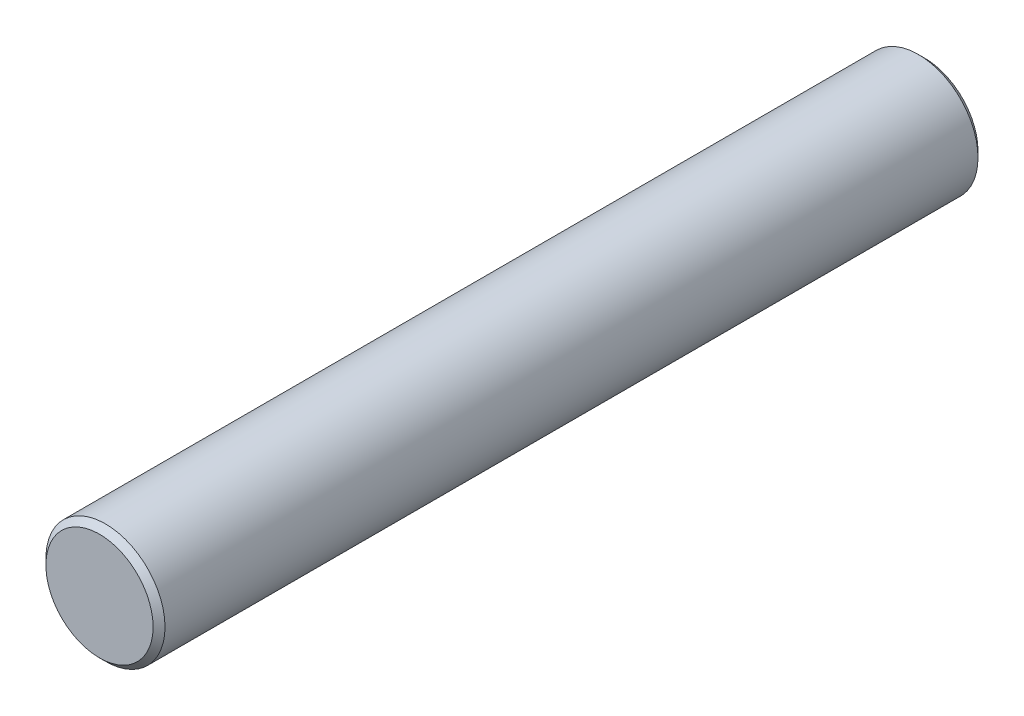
SolidWorks part; units mm, degrees
ref_plane "Plan de face" through (0, 0, 0) normal (0, 0, 1) x (1, 0, 0)
ref_plane "Plan de dessus" through (0, 0, 0) normal (0, 1, 0) x (1, 0, 0)
ref_plane "Plan de droite" through (0, 0, 0) normal (1, 0, 0) x (0, 0, -1)
sketch "Esquisse1" plane through (0, 0, 0) normal (0, 1, 0) x (1, 0, 0)
  line L0 (7, 88.5) -> (0, 84.294)
  line L1 (0, 84.294) -> (0, -138.5)
  line L2 (0, -138.5) -> (18, -138.5)
  line L3 (18, -138.5) -> (20, -136.5)
  line L4 (20, -136.5) -> (20, 136.5)
  line L5 (20, 136.5) -> (18, 138.5)
  line L6 (18, 138.5) -> (7, 138.5)
  line L7 (7, 138.5) -> (7, 88.5)
  line L8 (0, 138.5) -> (0, -138.5) construction
  dimension "D1" = 20
  dimension "D2" = 2
  dimension "D3" = 277
  dimension "D4" = 14
  dimension "D5" = 84.294
  dimension "D6" = 2
  dimension "D7" = 2
  dimension "D8" = 2
  dimension "D9" = 4.206
revolve "Révolution1" add sketch "Esquisse1" angle 360 about L8
